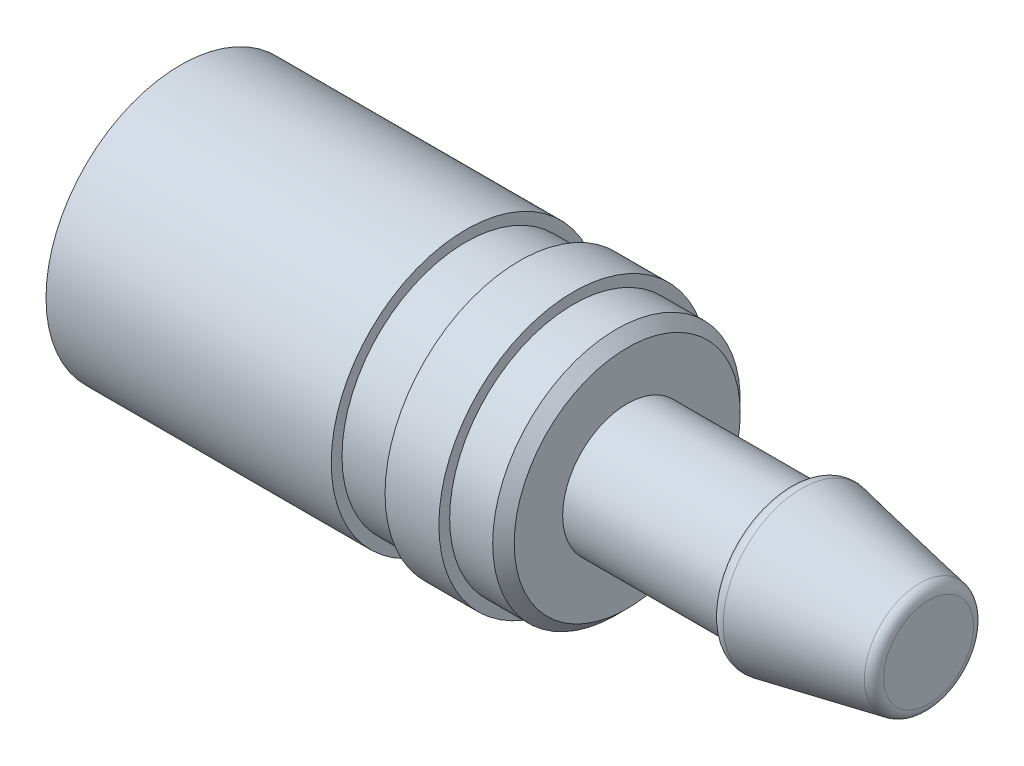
SolidWorks part; units mm, degrees
ref_plane "Alzado" through (0, 0, 0) normal (0, 0, 1) x (1, 0, 0)
ref_plane "Planta" through (0, 0, 0) normal (0, 1, 0) x (1, 0, 0)
ref_plane "Vista lateral" through (0, 0, 0) normal (1, 0, 0) x (0, 0, -1)
sketch "Croquis1" plane through (0, 0, 0) normal (0, 0, 1) x (1, 0, 0)
  line L0 (0, 0) -> (36.1529, 0) construction
  line L1 (0, 0) -> (0, 12.5)
  line L2 (0, 12.5) -> (26.5, 12.5)
  line L3 (26.5, 12.5) -> (26.5, 11.5)
  line L4 (26.5, 11.5) -> (31.5, 11.5)
  line L5 (31.5, 11.5) -> (31.5, 12.5)
  line L6 (31.5, 12.5) -> (36.5, 12.5)
  line L7 (36.5, 12.5) -> (36.5, 11.5)
  line L8 (36.5, 11.5) -> (41.5, 11.5)
  line L9 (41.5, 11.5) -> (41.5, 6)
  line L10 (41.5, 6) -> (56.5, 6)
  line L11 (56.5, 6) -> (56.5, 7.5)
  line L12 (56.5, 7.5) -> (69.5, 5)
  line L15 (0, 0) -> (69.5, 0)
  line L16 (69.5, 0) -> (69.5, 5)
  dimension "D1" = 25
  dimension "D2" = 26.5
  dimension "D3" = 1
  dimension "D4" = 5
  dimension "D5" = 5
  dimension "D6" = 5
  dimension "D7" = 12
  dimension "D8" = 15
  dimension "D9" = 10
  dimension "D10" = 28
  dimension "D11" = 15
revolve "Revolución1" add sketch "Croquis1" angle 360 about L0
fillet "Redondeo1" radius 1 2 edges at (69.5, 0, 5) (56.5, 0, 7.5)
chamfer "Chaflán1" distance 1 angle 45 1 edges at (41.5, 0, 11.5)
